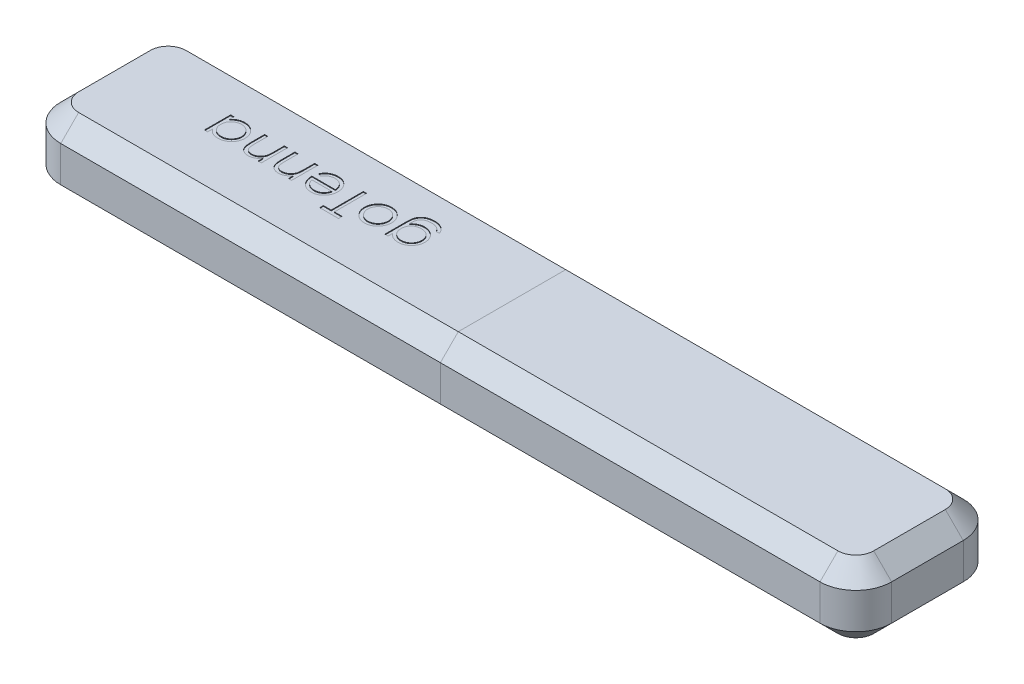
SolidWorks part; units mm, degrees
ref_plane "Front Plane" through (0, 0, 0) normal (0, 0, 1) x (1, 0, 0)
ref_plane "Top Plane" through (0, 0, 0) normal (0, 1, 0) x (1, 0, 0)
ref_plane "Right Plane" through (0, 0, 0) normal (1, 0, 0) x (0, 0, -1)
sketch "Sketch1" plane through (0, 0, 0) normal (1, 0, 0) x (0, 0, -1)
  line L1 (12.7, -6.35) -> (-12.7, -6.35)
  line L2 (12.7, -6.35) -> (12.7, 6.35)
  line L3 (12.7, 6.35) -> (-12.7, 6.35)
  line L4 (-12.7, -6.35) -> (-12.7, 6.35)
  line L5 (12.7, -6.35) -> (-12.7, 6.35) construction
  line L6 (12.7, 6.35) -> (-12.7, -6.35) construction
  point P0 (0, 0)
  dimension "D1" = 25.4
  dimension "D2" = 12.7
extrude "Boss-Extrude1" add sketch "Sketch1" along normal blind 73.66
sketch "Sketch2" plane through (0, 0, 0) normal (-1, 0, 0) x (0, 0, 1)
  line L4 (12.7, -6.35) -> (12.7, 6.35)
  line L5 (12.7, 6.35) -> (-12.7, 6.35)
  line L6 (-12.7, 6.35) -> (-12.7, -6.35)
  line L7 (-12.7, -6.35) -> (12.7, -6.35)
  line L8 (12.7, -6.35) -> (12.7, 6.35)
  line L9 (12.7, 6.35) -> (-12.7, 6.35)
  line L10 (-12.7, 6.35) -> (-12.7, -6.35)
  line L11 (-12.7, -6.35) -> (12.7, -6.35)
  dimension "D1" = 0
extrude "Boss-Extrude2" add sketch "Sketch2" along normal blind 73.66 separate body
fillet "Fillet1" radius 6.35 2 edges at (-73.66, 0, -12.7) (-73.66, 0, 12.7)
fillet "Fillet2" radius 6.35 2 edges at (73.66, 0, -12.7) (73.66, 0, 12.7)
chamfer "Chamfer1" distance 3.175 angle 45 10 edges at (-33.655, -6.35, -12.7) (-71.8001, -6.35, -10.8401) (-73.66, -6.35, 0) (-71.8001, -6.35, 10.8401) (-33.655, -6.35, 12.7) (-33.655, 6.35, -12.7) (-71.8001, 6.35, -10.8401) (-73.66, 6.35, 0) (-71.8001, 6.35, 10.8401) (-33.655, 6.35, 12.7)
chamfer "Chamfer2" distance 3.175 angle 45 10 edges at (33.655, -6.35, -12.7) (71.8001, -6.35, -10.8401) (73.66, -6.35, 0) (71.8001, -6.35, 10.8401) (33.655, -6.35, 12.7) (33.655, 6.35, -12.7) (71.8001, 6.35, -10.8401) (73.66, 6.35, 0) (71.8001, 6.35, 10.8401) (33.655, 6.35, 12.7)
sketch "Sketch3" plane through (0, 6.35, 0) normal (0, 1, 0) x (1, 0, 0)
  line L0 (-7.7777, 3.5794) -> (-62.3624, 3.5794) construction
  text T0 "goTenna" font "Century Gothic" height 6.35
extrude "Cut-Extrude1" cut sketch "Sketch3" against normal blind 0.127
